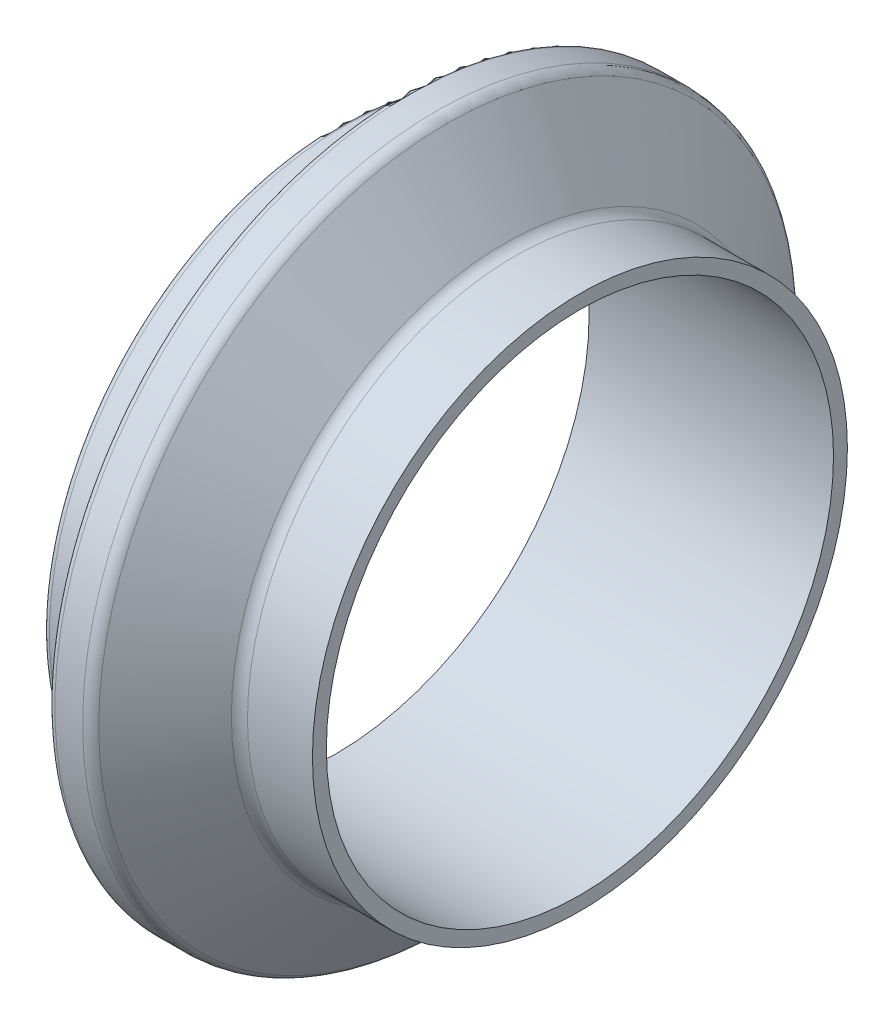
SolidWorks part; units mm, degrees
ref_plane "Front Plane" through (0, 0, 0) normal (0, 0, 1) x (1, 0, 0)
ref_plane "Top Plane" through (0, 0, 0) normal (0, 1, 0) x (1, 0, 0)
ref_plane "Right Plane" through (0, 0, 0) normal (1, 0, 0) x (0, 0, -1)
sketch "Sketch1" plane through (0, 0, 0) normal (0, 0, 1) x (1, 0, 0)
  line L0 (0, 0) -> (-37.0343, 0) construction
  line L1 (0, 30.099) -> (-29.0068, 30.099)
  line L2 (-29.0068, 30.099) -> (-29.0068, 33.9598)
  line L3 (-28.194, 34.7726) -> (-21.9456, 34.7726)
  line L4 (-21.1328, 35.5854) -> (-21.1328, 41.1861)
  line L5 (-20.32, 41.9989) -> (-17.0284, 41.9989)
  line L6 (-15.7505, 41.3617) -> (-8.9876, 32.3872)
  line L7 (-7.7097, 31.75) -> (0, 31.75)
  line L8 (0, 31.75) -> (0, 30.099)
  arc A0 (-20.32, 41.9989) -> (-21.1328, 41.1861) centre (-20.32, 41.1861) ccw
  arc A1 (-21.1328, 35.5854) -> (-21.9456, 34.7726) centre (-21.9456, 35.5854) cw
  arc A2 (-28.194, 34.7726) -> (-29.0068, 33.9598) centre (-28.194, 33.9598) ccw
  arc A3 (-7.7097, 31.75) -> (-8.9876, 32.3872) centre (-7.7097, 33.3502) cw
  arc A4 (-15.7505, 41.3617) -> (-17.0284, 41.9989) centre (-17.0284, 40.3987) ccw
  point P13 (-21.1328, 41.9989)
  point P18 (-29.0068, 34.7726)
  point P23 (-16.2306, 41.9989)
  dimension "D7" = 0.8128
  dimension "D8" = 1.6002
  dimension "D1" = 30.099
  dimension "D2" = 31.75
  dimension "D3" = 41.9989
  dimension "D4" = 34.7726
  dimension "D5" = 4.9022
  dimension "D6" = 7.874
  dimension "D9" = 29.0068
revolve "Revolve1" add sketch "Sketch1" angle 360 about L0
